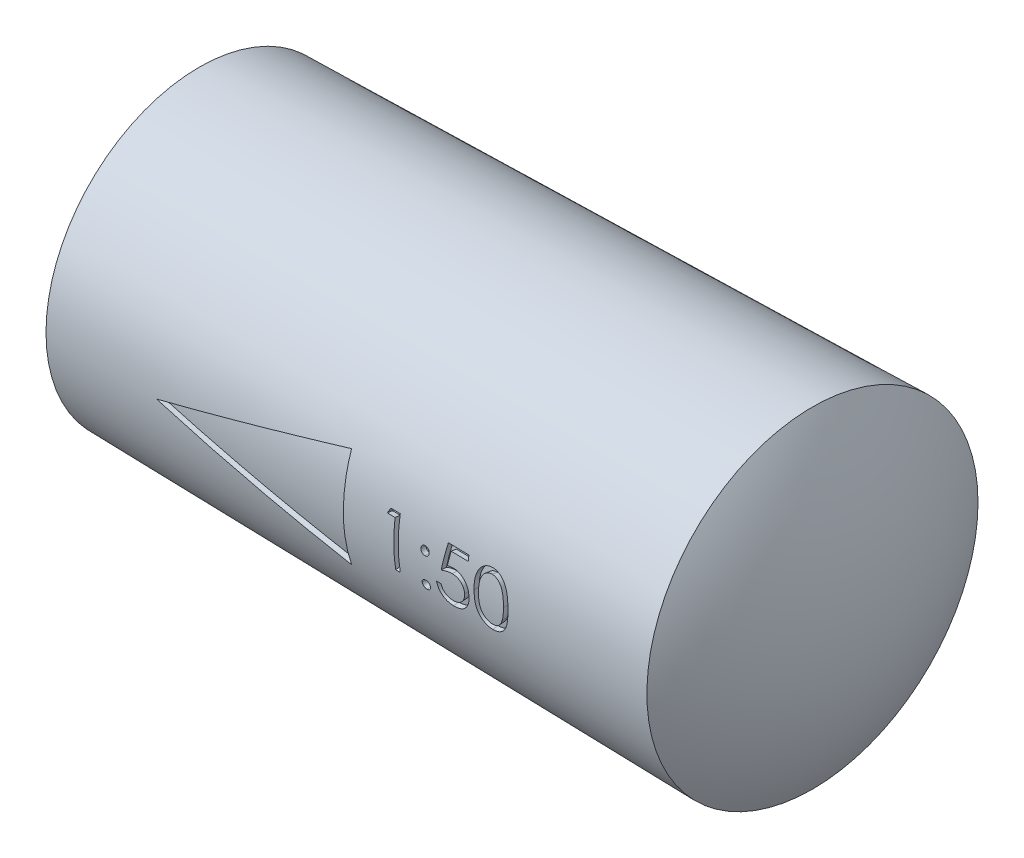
SolidWorks part; units mm, degrees
ref_plane "Front Plane" through (0, 0, 0) normal (0, 0, 1) x (1, 0, 0)
ref_plane "Top Plane" through (0, 0, 0) normal (0, 1, 0) x (1, 0, 0)
ref_plane "Right Plane" through (0, 0, 0) normal (1, 0, 0) x (0, 0, -1)
sketch "Sketch1" plane through (0, 0, 0) normal (1, 0, 0) x (0, 0, -1)
  circle A0 centre (0, 0) radius 3
  dimension "D1" = 6
extrude "Extrude1" add sketch "Sketch1" along normal mid plane 12
draft "Draft1" type of draft neutral plane draft angle 1.146 faces to draft 1 parameters "D1"=1.146
sketch "Sketch2" plane through (0, 0, 0) normal (0, 0, 1) x (1, 0, 0)
  line L0 (-6, 0) -> (-6, 3)
  line L1 (-6, 3) -> (-6, -3) construction
  line L2 (-6, 0) -> (-6.9, 0)
  line L3 (-6.9, 0) -> (-6.9, -3.12) construction
  line L4 (6, 0) -> (6, 3.24)
  line L5 (6, -3.24) -> (6, 3.24) construction
  line L6 (6, 0) -> (6.9, 0)
  line L7 (6.9, 0) -> (6.9, -3.12) construction
  line L8 (-6, -3) -> (6, -3.24) construction
  arc A0 (-6.9, 0) -> (-6, 3) centre (-1.45, 0) cw
  arc A1 (6.9, 0) -> (6, 3.24) centre (0.618, 0) ccw
  point P14 (0, -3.12)
revolve "Revolve1" add sketch "Sketch2" angle 360 about L2
sketch "Sketch5" plane through (0, 0, 0) normal (0, 0, 1) x (1, 0, 0)
  line L0 (0, 3.12) -> (0, -3.12) construction
  line L1 (6, 3.24) -> (-6, 3) construction
  line L2 (-6, -3) -> (6, -3.24) construction
ref_plane "Plane2" through (0, 0, 0) normal (-0.02, 0, 0.9998) x (0.9998, 0, 0.02)
sketch "Sketch6" plane through (0, 0, 0) normal (-0.02, 0, 0.9998) x (0.9998, 0, 0.02)
  line L0 (0, 0) -> (0, 1)
  line L1 (0, 3.12) -> (0, -3.12) construction
  line L2 (0, 1) -> (-3.7321, 0)
  line L3 (-3.7321, 0) -> (0, -1)
  line L4 (0, -1) -> (0, 0)
  line L5 (0, -0.5) -> (4, -0.5) construction
  text T0 "1:50" font "Century Gothic" height 1
  dimension "D1" = 2
  dimension "D2" = 30
  dimension "D3" = 4
wrap "Wrap2" sketch "Sketch6" wrap type deboss source sketch "Sketch6" thickness 0.1 parameters "D1"=0.1
equation "\"D2@Sketch2\" = \"D1@Sketch2\""
